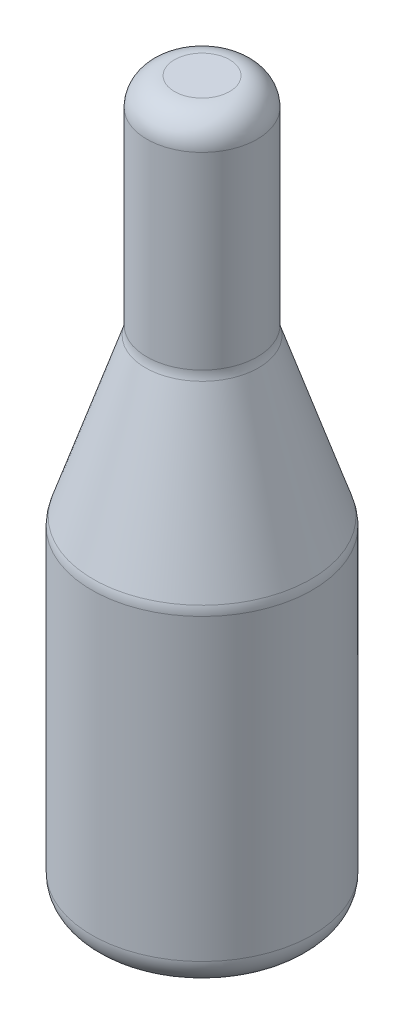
SolidWorks part; units mm, degrees
ref_plane "Front Plane" through (0, 0, 0) normal (0, 0, 1) x (1, 0, 0)
ref_plane "Top Plane" through (0, 0, 0) normal (0, 1, 0) x (1, 0, 0)
ref_plane "Right Plane" through (0, 0, 0) normal (1, 0, 0) x (0, 0, -1)
sketch "Sketch3" plane through (0, 0, 0) normal (0, 0, 1) x (1, 0, 0)
  line L0 (0, 0) -> (150, 0)
  line L1 (200, 50) -> (200, 591.8861)
  line L2 (0, 0) -> (0, 1300) construction
  line L3 (100, 1250) -> (100, 908.1139)
  line L4 (197.4342, 607.6975) -> (102.5658, 892.3025)
  line L5 (50, 1300) -> (0, 1300)
  line L6 (0, 0) -> (0, 1300)
  arc A0 (150, 0) -> (200, 50) centre (150, 50) ccw
  arc A1 (50, 1300) -> (100, 1250) centre (50, 1250) cw
  arc A2 (100, 908.1139) -> (102.5658, 892.3025) centre (150, 908.1139) ccw
  arc A3 (200, 591.8861) -> (197.4342, 607.6975) centre (150, 591.8861) ccw
  point P9 (200, 0)
  point P12 (100, 1300)
  point P15 (100, 900)
  point P18 (200, 600)
  dimension "D6" = 50
  dimension "D7" = 50
  dimension "D1" = 200
  dimension "D2" = 600
  dimension "D3" = 400
  dimension "D4" = 100
  dimension "D5" = 316.2278
revolve "Revolve3" add sketch "Sketch3" angle 360 about L2
